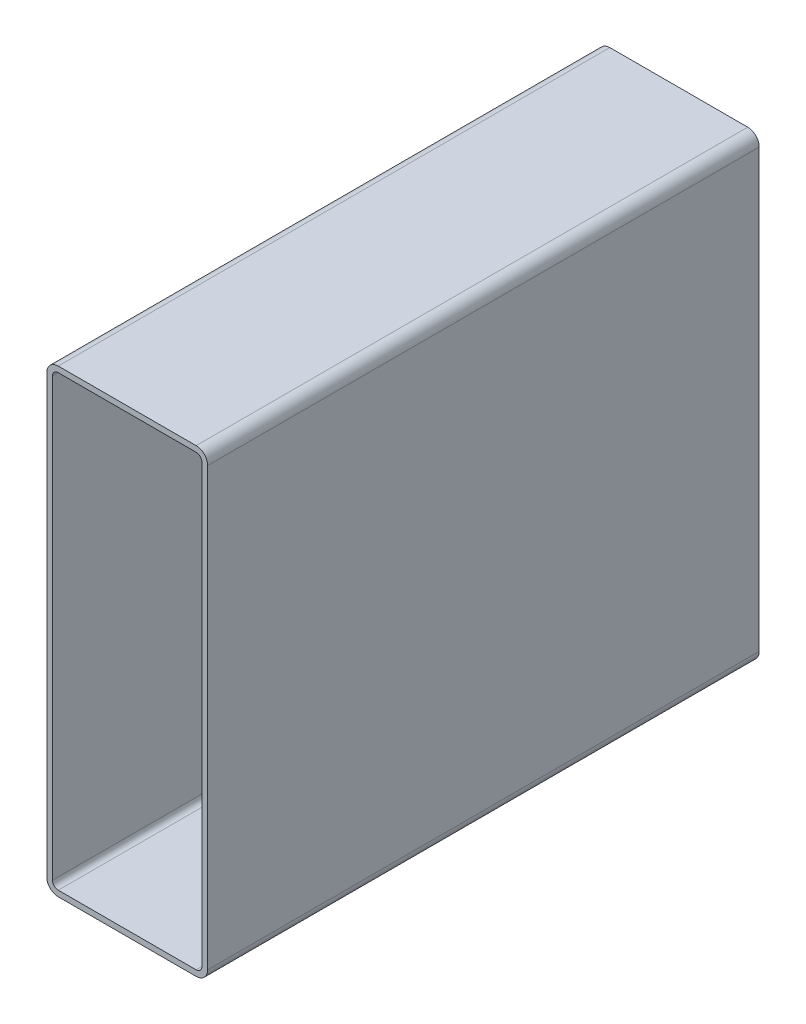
SolidWorks part; units mm, degrees
ref_plane "Front Plane" through (0, 0, 0) normal (0, 0, 1) x (1, 0, 0)
ref_plane "Top Plane" through (0, 0, 0) normal (0, 1, 0) x (1, 0, 0)
ref_plane "Right Plane" through (0, 0, 0) normal (1, 0, 0) x (0, 0, -1)
sketch "Sketch1" plane through (0, 0, 0) normal (0, 0, 1) x (1, 0, 0)
sketch_block_instance "HSS10x3.5x0.125-1"
sketch_block "HSS10x3.5x0.125"
extrude "Boss-Extrude1" add sketch "Sketch1" along normal blind 304.8
